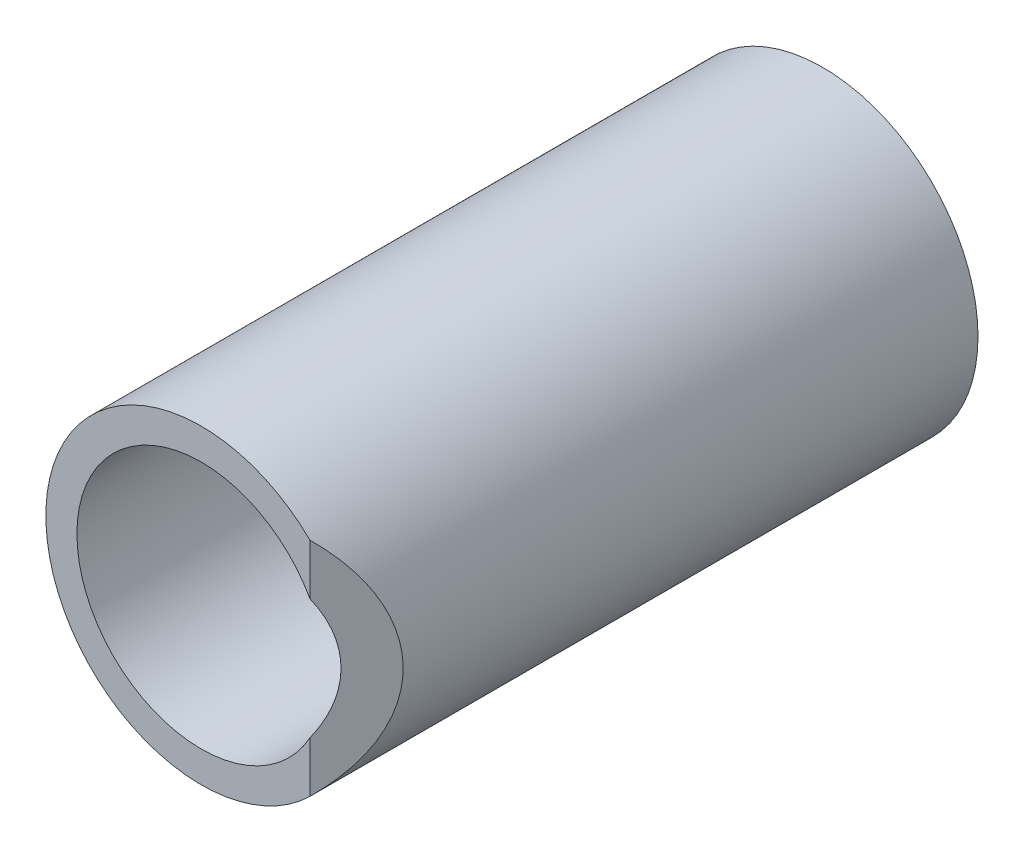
SolidWorks part; units mm, degrees
ref_plane "Front Plane" through (0, 0, 0) normal (0, 0, 1) x (1, 0, 0)
ref_plane "Top Plane" through (0, 0, 0) normal (0, 1, 0) x (1, 0, 0)
ref_plane "Right Plane" through (0, 0, 0) normal (1, 0, 0) x (0, 0, -1)
sketch "Sketch1" plane through (0, 0, 0) normal (0, 0, 1) x (1, 0, 0)
  circle A0 centre (0, 0) radius 25
  circle A1 centre (0, 0) radius 20
  dimension "D1" = 50
  dimension "D2" = 5
extrude "Boss-Extrude1" add sketch "Sketch1" along normal blind 100
ref_plane "Plane1" through (0, -25, 0) normal (0, -1, 0) x (-1, 0, 0)
sketch "Sketch2" plane through (0, -25, 0) normal (0, -1, 0) x (-1, 0, 0)
  line L0 (-17.5, -100) -> (-25, -92.5)
  line L1 (-25, -100) -> (25, -100) construction
  line L2 (-25, 0) -> (-25, -100) construction
  line L3 (-25, -92.5) -> (-25, -100)
  line L4 (-25, -100) -> (-17.5, -100)
  dimension "D1" = 7.5
  dimension "D2" = 7.5
extrude "Cut-Extrude1" cut sketch "Sketch2" against normal blind 500
